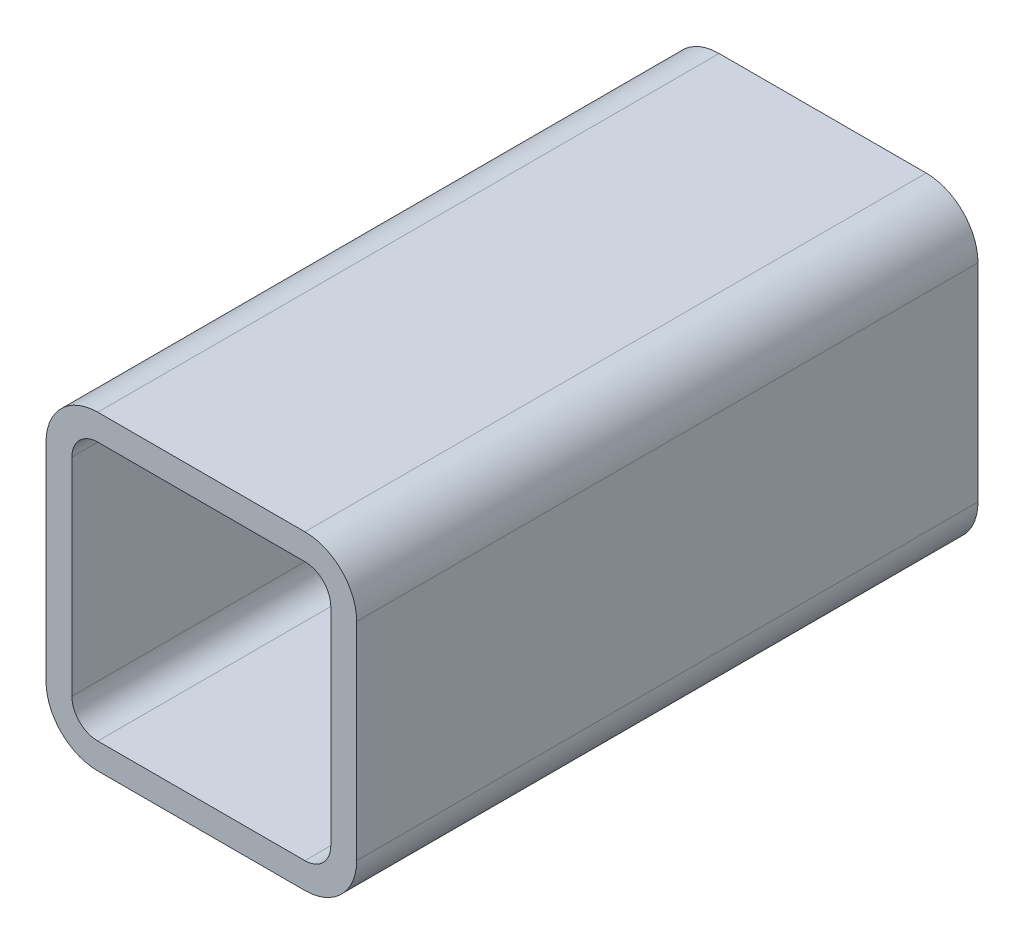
SolidWorks part; units mm, degrees
ref_plane "Front Plane" through (0, 0, 0) normal (0, 0, 1) x (1, 0, 0)
ref_plane "Top Plane" through (0, 0, 0) normal (0, 1, 0) x (1, 0, 0)
ref_plane "Right Plane" through (0, 0, 0) normal (1, 0, 0) x (0, 0, -1)
sketch "Sketch1" plane through (0, 0, 0) normal (0, 0, 1) x (1, 0, 0)
sketch_block_instance "HSS6x6x0.500-1"
sketch_block "HSS6x6x0.500"
extrude "Boss-Extrude1" add sketch "Sketch1" along normal blind 304.8
